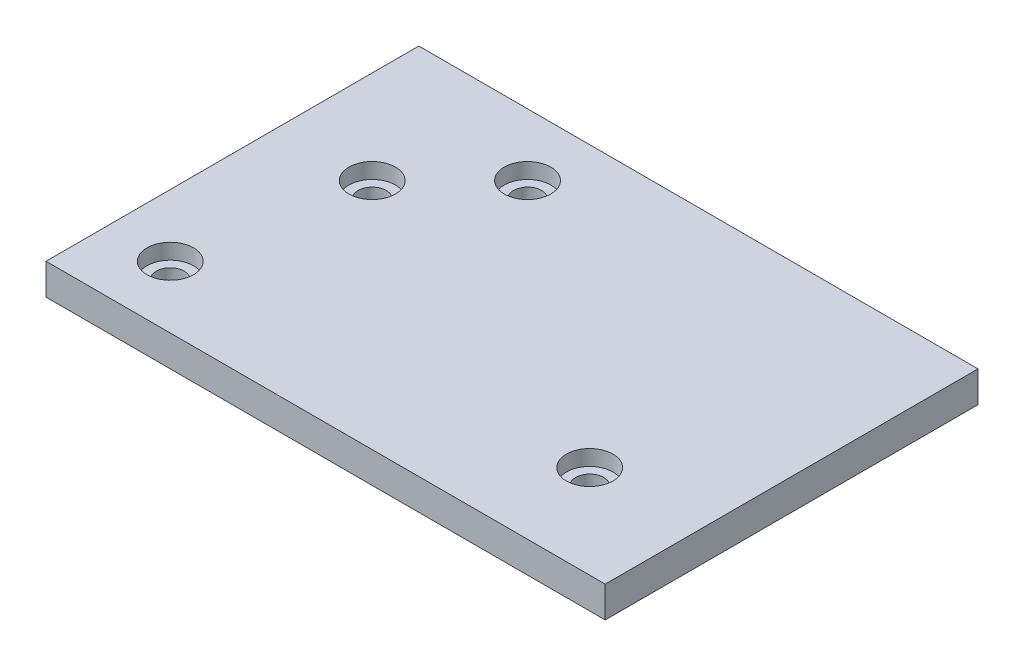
SolidWorks part; units mm, degrees
ref_plane "Vorderansicht" through (0, 0, 0) normal (0, 0, 1) x (1, 0, 0)
ref_plane "Draufsicht" through (0, 0, 0) normal (0, 1, 0) x (1, 0, 0)
ref_plane "Seitenansicht" through (0, 0, 0) normal (1, 0, 0) x (0, 0, -1)
sketch "Sketch1" plane through (0, 0, 0) normal (0, 1, 0) x (1, 0, 0)
  line L0 (90, 60) -> (-90, -60) construction
  line L1 (90, 60) -> (-90, 60)
  line L2 (90, 60) -> (90, -60)
  line L3 (90, -60) -> (-90, -60)
  line L4 (-90, 60) -> (-90, -60)
  dimension "D1" = 120
  dimension "D2" = 180
extrude "Extrude1" add sketch "Sketch1" along normal mid plane 10
sketch "Sketch2" plane through (0, 5, 0) normal (0, 1, 0) x (-1, 0, 0)
  line L0 (90, 60) -> (-90, 60) construction
  line L1 (90, -60) -> (90, 60) construction
  circle A0 centre (70, 40) radius 4.5
  dimension "D3" = 9
  dimension "D1" = 20
  dimension "D2" = 20
extrude "Cut-Extrude1" cut sketch "Sketch2" against normal up to next
sketch "Sketch3" plane through (0, 5, 0) normal (0, 1, 0) x (-1, 0, 0)
  circle A0 centre (70, 40) radius 7.5
  dimension "D1" = 15
extrude "Cut-Extrude2" cut sketch "Sketch3" against normal blind 5
sketch "Sketch4" plane through (0, 5, 0) normal (0, 1, 0) x (-1, 0, 0)
  circle A0 centre (70, 40) radius 4.5 construction
  point P0 (60, -15)
  point P1 (35, -40)
  point P2 (-55, 30)
  dimension "D1" = 55
  dimension "D2" = 10
  dimension "D3" = 35
  dimension "D4" = 80
  dimension "D5" = 125
  dimension "D6" = 10
pattern_sketch "Sketch-Pattern1" of "Cut-Extrude1", "Cut-Extrude2"
other "DeleteFace1"
